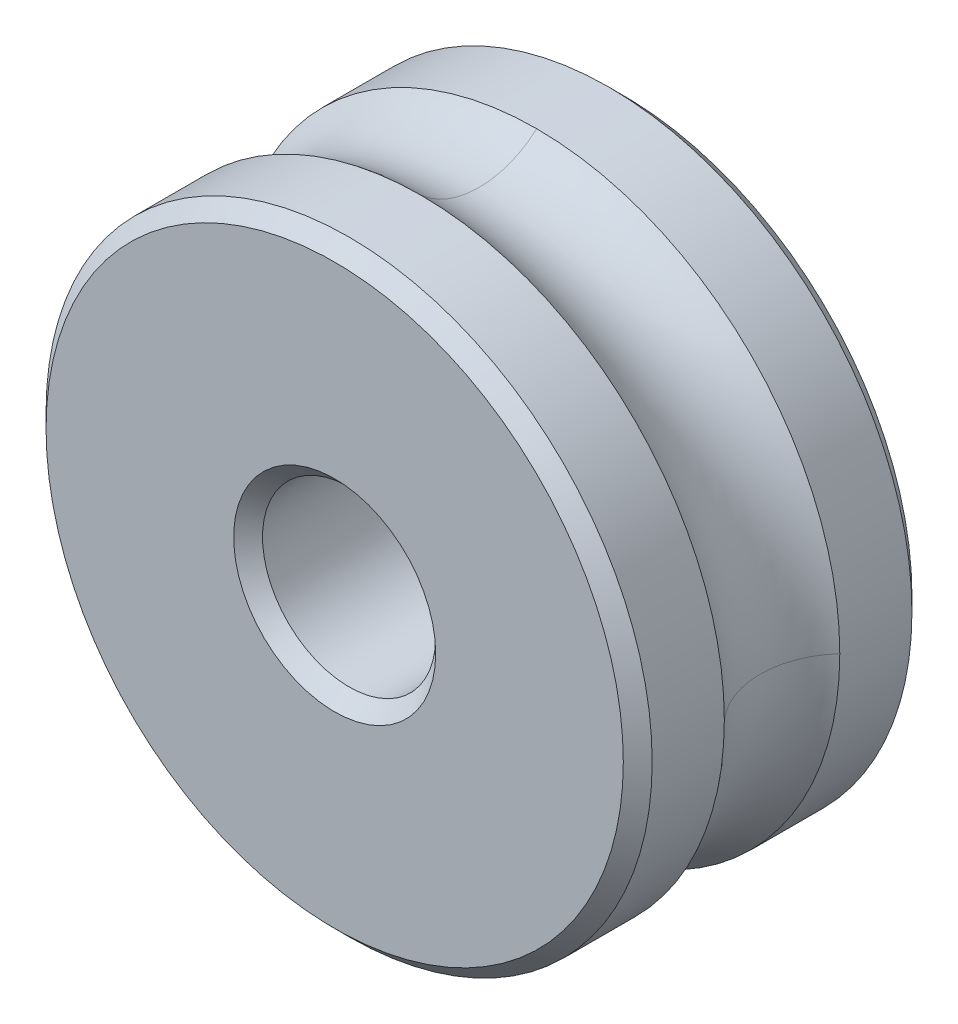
SolidWorks part; units mm, degrees
ref_plane "Front Plane" through (0, 0, 0) normal (0, 0, 1) x (1, 0, 0)
ref_plane "Top Plane" through (0, 0, 0) normal (0, 1, 0) x (1, 0, 0)
ref_plane "Right Plane" through (0, 0, 0) normal (1, 0, 0) x (0, 0, -1)
sketch "Szkic1" plane through (0, 0, 0) normal (0, 0, 1) x (1, 0, 0)
  circle A0 centre (0, 0) radius 21
  circle A2 centre (0, 0) radius 6
  dimension "D1" = 42
  dimension "D2" = 12
extrude "Dodanie-wyciągnięcie1" add sketch "Szkic1" along normal mid plane 20 contours A0 A2
chamfer "Sfazowanie1" distance 1 angle 45 4 edges at (21, 0, -10) (21, 0, 10) (6, 0, -10) (6, 0, 10)
sketch "Szkic3" plane through (0, 0, 0) normal (1, 0, 0) x (0, 0, -1)
  circle A1 centre (0, 25.4721) radius 6
  dimension "D1" = 12
  dimension "D2" = 25.4721
sweep "Wycięcie-wyciągnięcie po ścieżce1" cut profiles "Szkic3"
